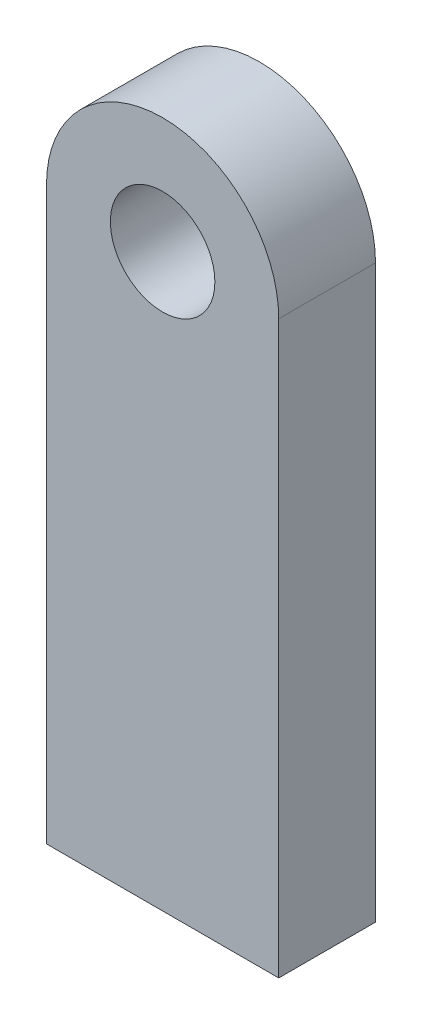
SolidWorks part; units mm, degrees
ref_plane "Front Plane" through (0, 0, 0) normal (0, 0, 1) x (1, 0, 0)
ref_plane "Top Plane" through (0, 0, 0) normal (0, 1, 0) x (1, 0, 0)
ref_plane "Right Plane" through (0, 0, 0) normal (1, 0, 0) x (0, 0, -1)
sketch "Sketch1" plane through (0, 0, 0) normal (0, 0, 1) x (1, 0, 0)
  line L1 (0, 0) -> (15.24, 0)
  line L2 (0, 0) -> (0, 37.465)
  line L3 (0, 37.465) -> (15.24, 37.465)
  line L4 (15.24, 0) -> (15.24, 37.465)
  arc A0 (0, 37.465) -> (15.24, 37.465) centre (7.62, 37.465) cw
  circle A1 centre (7.62, 37.465) radius 3.429
  dimension "D2" = 6.858
  dimension "D1" = 37.465
  dimension "D3" = 15.24
extrude "Boss-Extrude1" add sketch "Sketch1" along normal blind 6.35 contours A1 L3 L2 L1 L4 | A1 L3 A0
